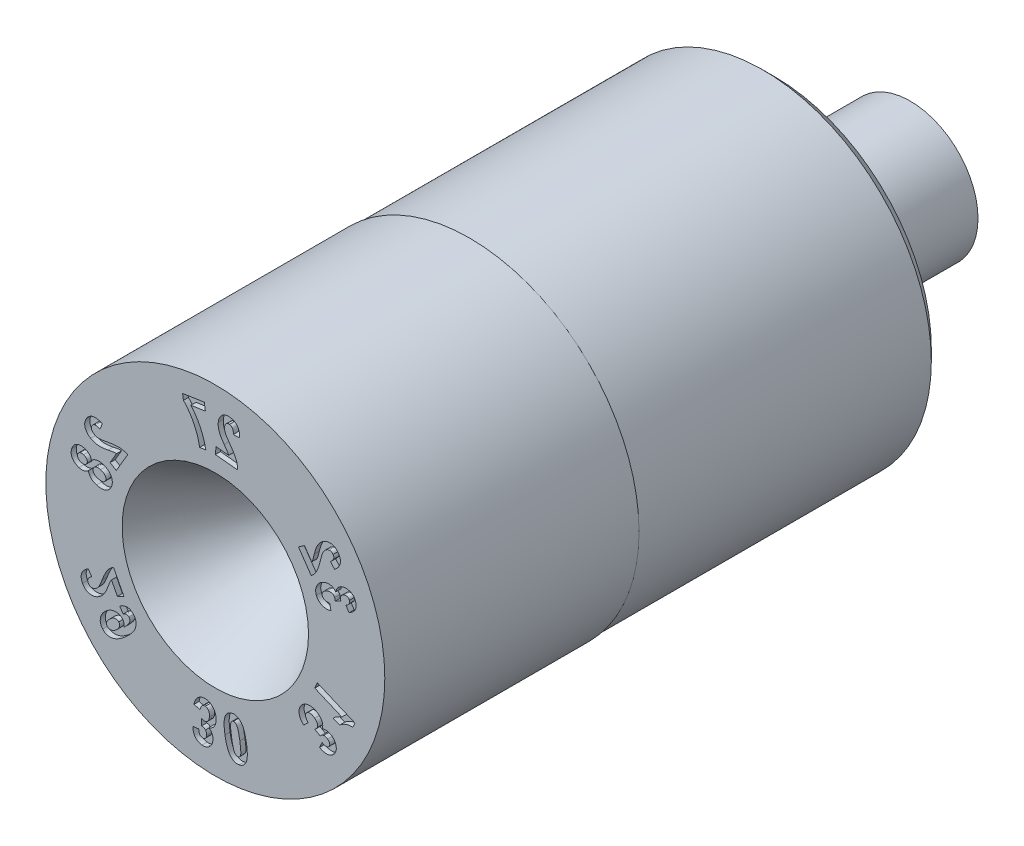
SolidWorks part; units mm, degrees
other "<M8L16-SetScrew>-<Chamfer1>"
ref_plane "Front Plane" through (0, 0, 0) normal (0, 0, 1) x (1, 0, 0)
ref_plane "Top Plane" through (0, 0, 0) normal (0, 1, 0) x (1, 0, 0)
ref_plane "Right Plane" through (0, 0, 0) normal (1, 0, 0) x (0, 0, -1)
sketch "Sketch1" plane through (0, 0, 0) normal (1, 0, 0) x (0, 0, -1)
  line L0 (0, 5.5) -> (6.4952, 1.75)
  line L2 (0, 10) -> (0, 5.5)
  line L3 (32.2458, 10) -> (0, 10)
  line L4 (-3.7979, 0) -> (49996.2021, 0) construction
  line L8 (25, 1.75) -> (6.4952, 1.75)
  line L12 (33, 4) -> (33, 9.2457)
  line L16 (33, 9.2457) -> (32.2458, 10)
  line L17 (33, 4) -> (25, 4)
  line L18 (25, 1.75) -> (25, 4)
  dimension "D1" = 33
  dimension "D2" = 45
  dimension "D3" = 0.7542
  dimension "D4" = 20
  dimension "D5" = 30
  dimension "D6" = 5.5
  dimension "D7" = 3.5
  dimension "D8" = 8
  dimension "D9" = 8
revolve "Revolve1" add sketch "Sketch1" angle 360 about L4
sketch "Sketch5" plane through (0, 0, 0) normal (1, 0, 0) x (0, 0, -1)
  line L0 (0, 0) -> (50000, 0) construction
  line L1 (0, 10) -> (0, -10) construction
  line L2 (15, 9.935) -> (33, 9.935)
  line L3 (15, 9.935) -> (15, 10.935)
  line L4 (15, 10.935) -> (33, 10.935)
  line L5 (33, 9.935) -> (33, 10.935)
  line L6 (33, -9.2457) -> (33, 9.2457) construction
  line L7 (32.2458, 10) -> (0, 10) construction
  dimension "D1" = 15
  dimension "D2" = 0.065
  dimension "D3" = 1
revolve "Cut-Revolve1" cut sketch "Sketch5" angle 360 about L0
sketch "Sketch2" plane through (0, 0, 0) normal (0, 0, 1) x (1, 0, 0)
  line L0 (0, 0) -> (0, 10) construction
  line L1 (0, 0) -> (8.6603, 5) construction
  line L2 (0, 0) -> (8.6603, -5) construction
  line L3 (0, 0) -> (0, -10) construction
  line L4 (0, 0) -> (-8.6603, -5) construction
  line L5 (0, 0) -> (-8.6603, 5) construction
  arc A0 (1.3857, 6.2994) -> (3.1694, 5.6176) centre (0, 0) ccw construction
  circle A1 centre (0, 0) radius 10 construction
  text T0 "27     28    29    30    31    32" font "Arial Narrow" height 2.4
  point P18 (0, 0)
  dimension "D1" = 12.9
  dimension "D2" = 6
extrude "Cut-Extrude1" cut sketch "Sketch2" against normal blind 0.3
ref_plane "Plane1" through (0, 0, -6.4952) normal (0, 0, 1) x (1, 0, 0)
sketch "Sketch6" plane through (0, 0, -6.4952) normal (0, 0, 1) x (1, 0, 0)
  line L1 (2.0207, 0) -> (1.0104, 1.75)
  line L2 (1.0104, 1.75) -> (-1.0104, 1.75)
  line L3 (-1.0104, 1.75) -> (-2.0207, 0)
  line L4 (-2.0207, 0) -> (-1.0104, -1.75)
  line L5 (-1.0104, -1.75) -> (1.0104, -1.75)
  line L6 (1.0104, -1.75) -> (2.0207, 0)
  circle A0 centre (0, 0) radius 1.75 construction
  circle A1 centre (0, 0) radius 1.75 construction
  point P1 (0, 1.75)
extrude "Cut-Extrude2" cut sketch "Sketch6" against normal blind 3.5 contours L3 L4 L5 L6 L1 L2
inserted part "M8L16-SetScrew"
move or copy body "Body-Move/Copy2" placed by mates yes
other "Distance1" parameters "D1"=8
